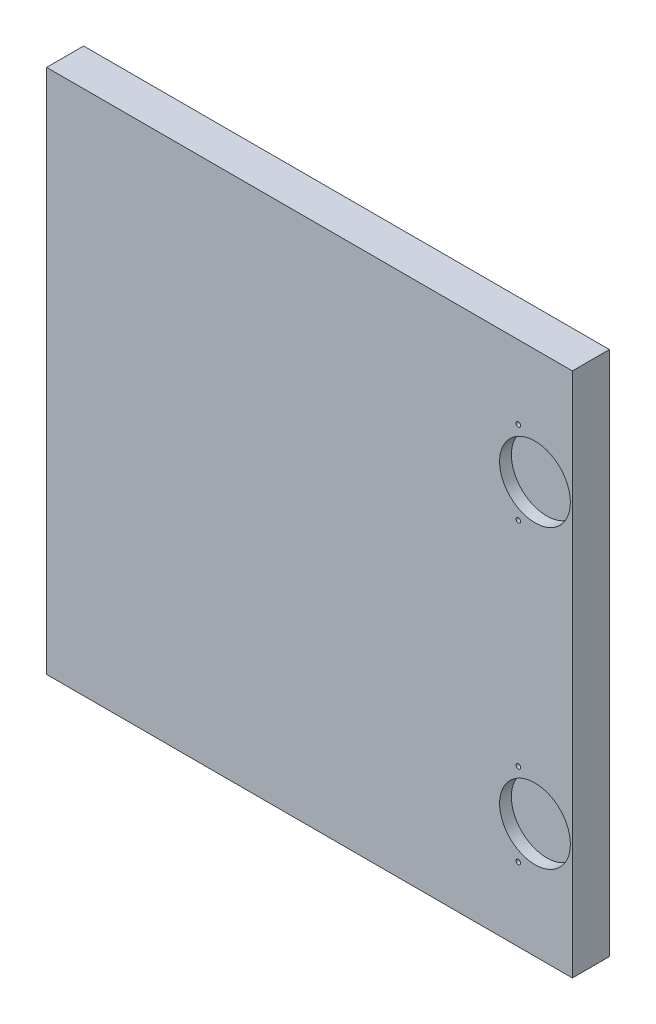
SolidWorks part; units mm, degrees
ref_plane "Plan de face" through (0, 0, 0) normal (0, 0, 1) x (1, 0, 0)
ref_plane "Plan de dessus" through (0, 0, 0) normal (0, 1, 0) x (1, 0, 0)
ref_plane "Plan de droite" through (0, 0, 0) normal (1, 0, 0) x (0, 0, -1)
body saved out of another part "Stock-cabinet base part-1"
sketch "Esquisse1" plane through (0, 0, -20) normal (0, 0, -1) x (-1, 0, 0)
  line L8 (142.0625, 142.0625) -> (-142.0625, 142.0625)
  line L9 (-142.0625, 142.0625) -> (-142.0625, -142.0625)
  line L10 (-142.0625, -142.0625) -> (142.0625, -142.0625)
  line L11 (142.0625, -142.0625) -> (142.0625, 142.0625)
  line L12 (142.0625, 142.0625) -> (-142.0625, 142.0625)
  line L13 (-142.0625, 142.0625) -> (-142.0625, -142.0625)
  line L14 (-142.0625, -142.0625) -> (142.0625, -142.0625)
  line L15 (142.0625, -142.0625) -> (142.0625, 142.0625)
  dimension "D1" = 7.9375
extrude "Enlèv. mat.-Extru.1" cut sketch "Esquisse1" against normal through all flip side to cut
